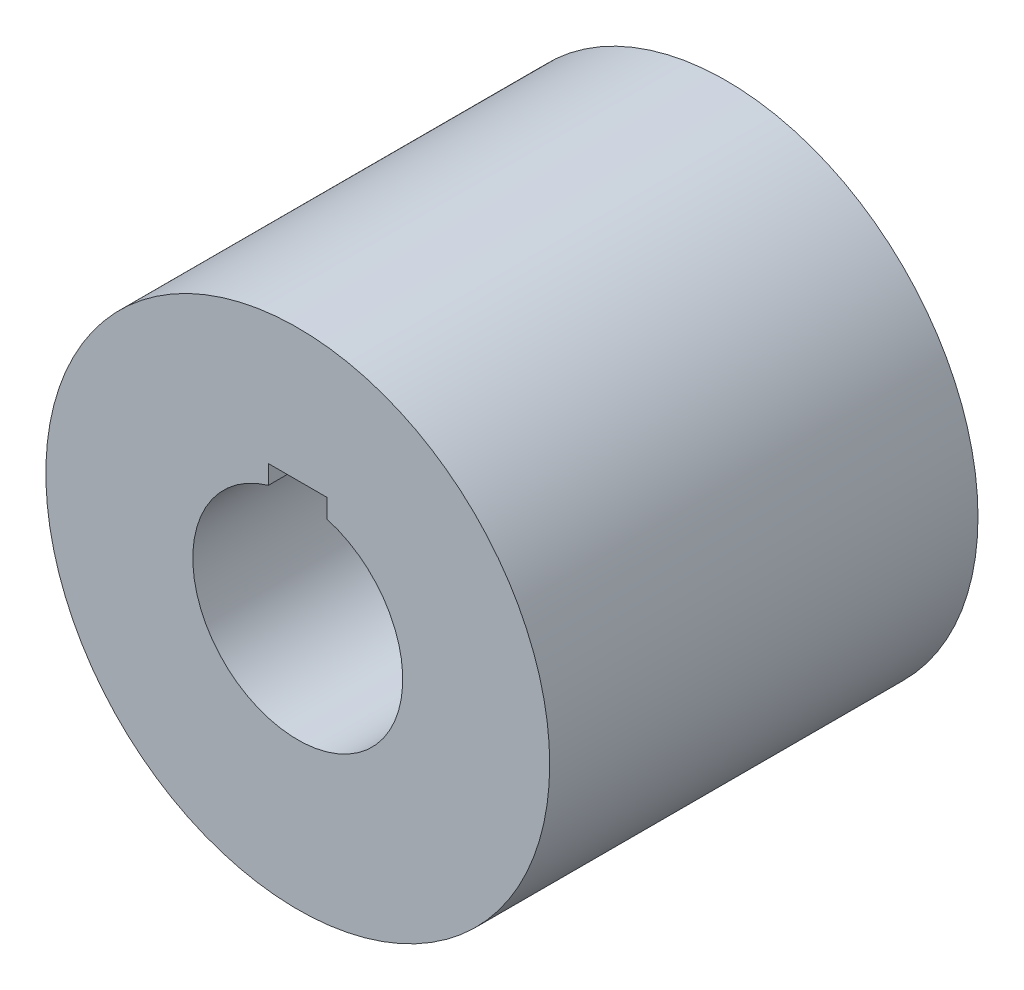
SolidWorks part; units mm, degrees
ref_plane "Face" through (0, 0, 0) normal (0, 0, 1) x (1, 0, 0)
ref_plane "Dessus" through (0, 0, 0) normal (0, 1, 0) x (1, 0, 0)
ref_plane "Droite" through (0, 0, 0) normal (1, 0, 0) x (0, 0, -1)
sketch "Esquisse1" plane through (0, 0, 0) normal (0, 0, 1) x (1, 0, 0)
  circle A0 centre (0, 0) radius 60
  dimension "D1" = 120
extrude "Extrusion1" add sketch "Esquisse1" along normal mid plane 102
sketch "Esquisse2" plane through (0, 0, 51) normal (0, 0, 1) x (1, 0, 0)
  line L1 (7, 28.5) -> (-7, 28.5)
  line L2 (7, 28.5) -> (7, 24)
  line L4 (-7, 28.5) -> (-7, 24)
  arc A0 (-7, 24) -> (7, 24) centre (0, 0) ccw
  dimension "D1" = 50
  dimension "D2" = 14
  dimension "D3" = 7
  dimension "D4" = 28.5
extrude "Enlèv. mat.-Extru.1" cut sketch "Esquisse2" against normal through all
